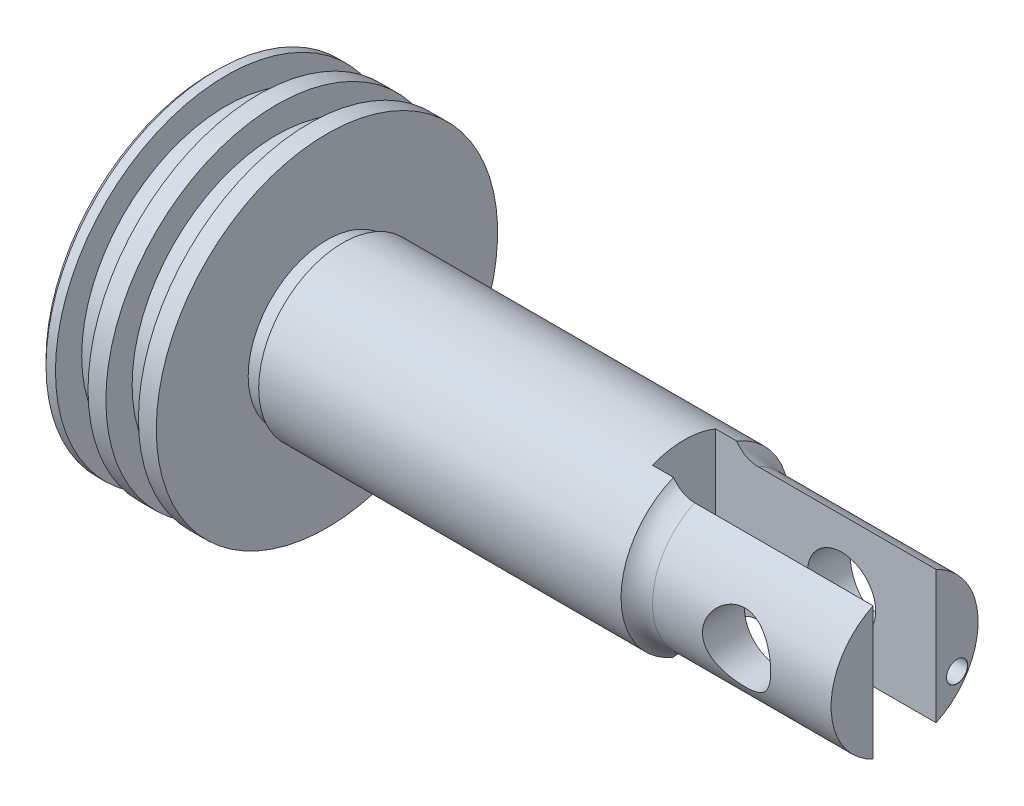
SolidWorks part; units mm, degrees
ref_plane "前视基准面" through (0, 0, 0) normal (0, 0, 1) x (1, 0, 0)
ref_plane "上视基准面" through (0, 0, 0) normal (0, 1, 0) x (1, 0, 0)
ref_plane "右视基准面" through (0, 0, 0) normal (1, 0, 0) x (0, 0, -1)
other "Configuration Table"
sketch "草图1" plane through (0, 0, 0) normal (0, 0, 1) x (1, 0, 0)
  line L1 (0, 0) -> (2.8, 0)
  line L2 (0, 0) -> (0, 32.5)
  line L3 (0, 32.5) -> (2.8, 32.5)
  line L4 (2.8, 0) -> (2.8, 32.5)
  line L5 (2.8, 0) -> (9, 0)
  line L6 (2.8, 0) -> (2.8, 27.5)
  line L7 (2.8, 27.5) -> (9, 27.5)
  line L8 (9, 0) -> (9, 27.5)
  line L9 (9, 0) -> (12.4, 0)
  line L10 (9, 0) -> (9, 32.5)
  line L11 (9, 32.5) -> (12.4, 32.5)
  line L12 (12.4, 0) -> (12.4, 32.5)
  line L13 (12.4, 0) -> (18.6, 0)
  line L14 (12.4, 0) -> (12.4, 27.5)
  line L15 (12.4, 27.5) -> (18.6, 27.5)
  line L16 (18.6, 0) -> (18.6, 27.5)
  line L17 (18.6, 0) -> (22, 0)
  line L18 (18.6, 0) -> (18.6, 32.5)
  line L19 (18.6, 32.5) -> (22, 32.5)
  line L20 (22, 0) -> (22, 32.5)
  line L21 (22, 0) -> (25, 0)
  line L22 (22, 0) -> (22, 15)
  line L23 (22, 15) -> (25, 15)
  line L24 (25, 0) -> (25, 15)
  line L26 (25, 0) -> (25, 16)
  line L48 (25, 0) -> (94, 0)
  line L49 (25, 0) -> (25, 16)
  line L50 (25, 16) -> (94, 16)
  line L51 (94, 0) -> (94, 14) construction
  line L52 (94, 0) -> (132, 0)
  line L53 (94, 0) -> (94, 14) construction
  line L54 (98, 14) -> (132, 14)
  line L55 (132, 0) -> (132, 14)
  arc A2 (94, 16) -> (98, 14) centre (98, 19) ccw
  dimension "D11" = 14
  dimension "D10" = 16
  dimension "D12" = 10
  dimension "D1" = 22
  dimension "D2" = 32.5
  dimension "D3" = 27.5
  dimension "D4" = 6.2
  dimension "D5" = 6.2
  dimension "D6" = 3.4
  dimension "D7" = 3.4
  dimension "D8" = 3
  dimension "D9" = 15
  dimension "D13" = 38
  dimension "D14" = 132
revolve "旋转2" add sketch "草图1" angle 360 about L13
sketch "草图2" plane through (0, 0, 0) normal (0, 0, 1) x (1, 0, 0)
  line L0 (0, 32.5) -> (0, -32.5) construction
  circle A0 centre (114, 0) radius 6.5
  dimension "D1" = 13
  dimension "D2" = 114
extrude "切除-拉伸1" cut sketch "草图2" against normal mid plane 111
sketch "草图3" plane through (132, 0, 0) normal (1, 0, 0) x (0, 0, -1)
  line L1 (-6, -20.371) -> (6, -20.371)
  line L2 (-6, -20.371) -> (-6, 20.371)
  line L3 (-6, 20.371) -> (6, 20.371)
  line L4 (6, -20.371) -> (6, 20.371)
  line L5 (-6, -20.371) -> (6, 20.371) construction
  line L6 (-6, 20.371) -> (6, -20.371) construction
  point P0 (0, 0)
  dimension "D1" = 12
extrude "切除-拉伸2" cut sketch "草图3" against normal blind 42
hole_wizard "Ø4.0mm 暗销孔1" positions "草图9" profile "草图8" hole size "Ø4.0" standard "GB"
sketch "草图9" plane through (132, 0, 0) normal (1, 0, 0) x (0, 0, -1)
  line L0 (6, -14.8324) -> (6, 14.8324) construction
  point P0 (10, -6.179)
  dimension "D1" = 4
sketch "草图8" plane through (132, -6.179, -10) normal (0, 1, 0) x (0, 0, -1)
  line L0 (0, 0) -> (0, 15.2017)
  line L1 (0, 15.2017) -> (2, 14)
  line L2 (2, 14) -> (2, 0.025)
  line L3 (2, 0.025) -> (2.025, 0)
  line L5 (2.025, 0) -> (0, 0)
  line L6 (-2, 0.025) -> (-2.025, 0) construction
  line L10 (0, 15.2017) -> (-2, 14) construction
  line L11 (0, -6.35) -> (0, 107.95) construction
  dimension "孔直径" = 4
  dimension "孔深度" = 14
  dimension "近端锥形沉头孔直径" = 4.05
  dimension "近端锥形沉头孔角度" = 90
  dimension "导头角度" = 118
chamfer "倒角1" distance 1 angle 45 1 edges at (0, 0, 32.5)
